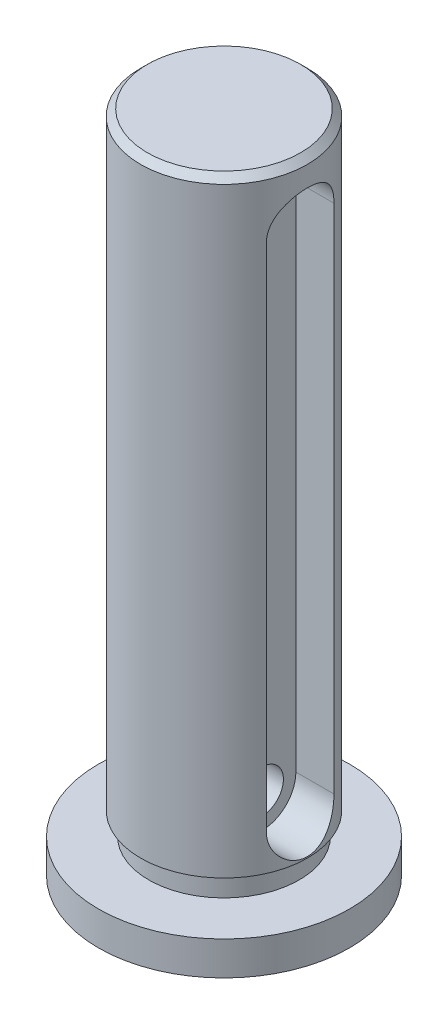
SolidWorks part; units mm, degrees
ref_plane "front" through (0, 0, 0) normal (0, 0, 1) x (1, 0, 0)
ref_plane "top" through (0, 0, 0) normal (0, 1, 0) x (1, 0, 0)
ref_plane "side" through (0, 0, 0) normal (1, 0, 0) x (0, 0, -1)
sketch "Sketch1" plane through (0, 0, 0) normal (0, 0, 1) x (1, 0, 0)
  line L0 (4.7244, 0.8128) -> (4.7244, 2.0828)
  line L1 (4.7244, 2.0828) -> (2.8321, 2.0828)
  line L2 (2.8321, 2.0828) -> (2.8321, 2.9464)
  line L3 (2.8321, 2.9464) -> (3.1369, 2.9464)
  line L4 (3.1369, 2.9464) -> (3.1369, 25.8064)
  line L5 (3.1369, 25.8064) -> (0, 25.8064)
  line L6 (0, -50) -> (0, 50) construction
  line L7 (0, 25.8064) -> (0, 0)
  line L8 (0, 12.9032) -> (0, -14.0989) construction
  line L9 (0, 0) -> (-7.0745, 0) construction
  arc A0 (0, 0) -> (4.7244, 0.8128) centre (0, 14.1367) ccw
  point P15 (14.392, 1.2073)
  dimension "D1" = 2.0828
  dimension "D2" = 1.27
  dimension "D3" = 25.8064
  dimension "D4" = 0.8636
  dimension "D5" = 6.2738
  dimension "D6" = 9.4488
  dimension "D7" = 5.6642
revolve "Revolve1" add sketch "Sketch1" angle 360 about L8
ref_plane "Plane1" through (2.8321, 0, 0) normal (1, 0, 0) x (0, 0, -1)
sketch "Sketch3" plane through (2.8321, 0, 0) normal (1, 0, 0) x (0, 0, -1)
  line L0 (0, 25.8064) -> (0, 0) construction
  line L2 (0, 23.5204) -> (0, 4.2672) construction
  line L3 (1.27, 23.5204) -> (1.27, 4.2672)
  line L4 (-1.27, 23.5204) -> (-1.27, 4.2672)
  line L7 (3.1369, 25.8064) -> (-3.1369, 25.8064) construction
  arc A0 (1.27, 23.5204) -> (-1.27, 23.5204) centre (0, 23.5204) ccw
  arc A1 (-1.27, 4.2672) -> (1.27, 4.2672) centre (0, 4.2672) ccw
  point P2 (0, 0)
  point P7 (0, 13.8938)
  point P13 (0, 24.7904)
  point P15 (0, 0)
  dimension "D1" = 21.7932
  dimension "D2" = 2.54
  dimension "D3" = 1.016
extrude "Cut-Extrude2" cut sketch "Sketch3" against normal blind 1.397 and the other way blind 1.016
sketch "Sketch4" plane through (1.4351, 0, 0) normal (1, 0, 0) x (0, 0, -1)
  circle A0 centre (0, 23.5204) radius 0.8001
  circle A1 centre (0, 4.2672) radius 0.8001
  point P6 (0, 0)
  dimension "D1" = 1.6002
extrude "Cut-Extrude4" cut sketch "Sketch4" against normal blind 1.1176
chamfer "Chamfer2" distance 0.254 angle 45 1 edges at (-3.1369, 25.8064, 0)
